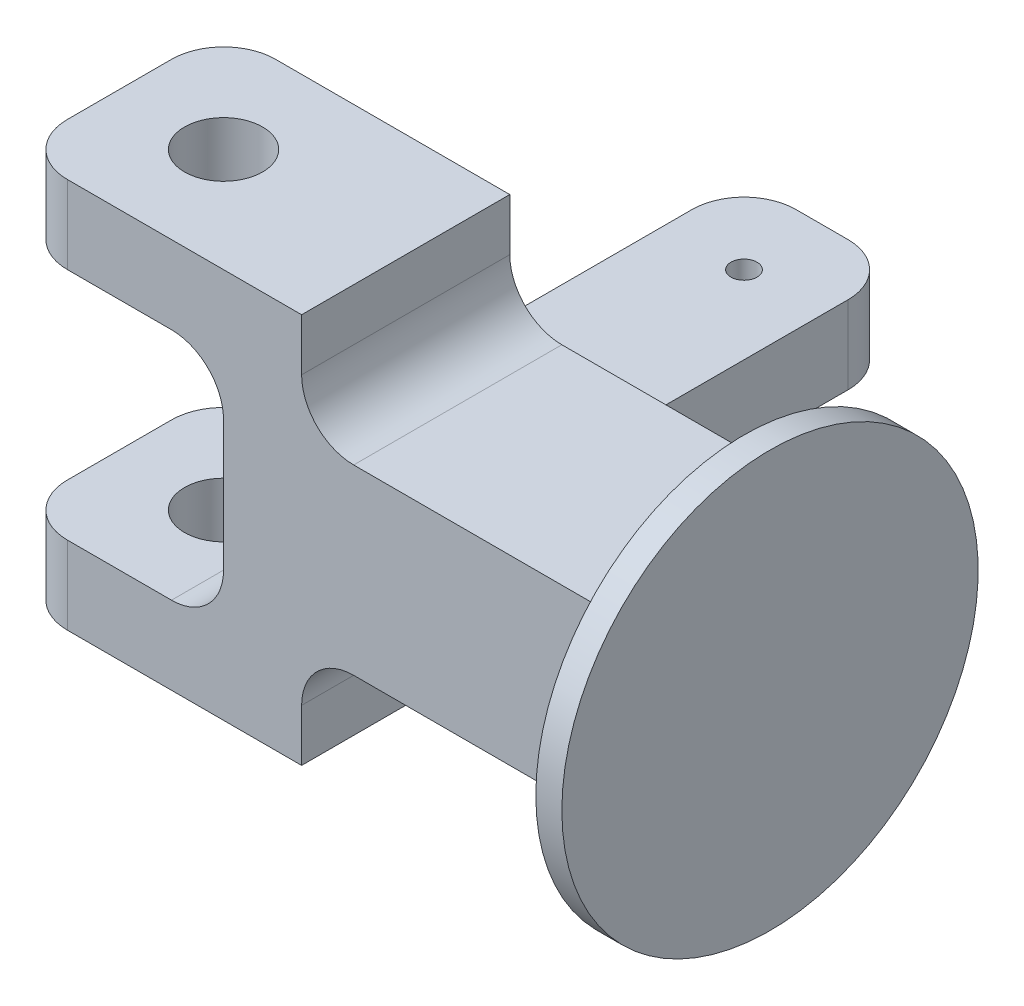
SolidWorks part; units mm, degrees
ref_plane "Front Plane" through (0, 0, 0) normal (0, 0, 1) x (1, 0, 0)
ref_plane "Top Plane" through (0, 0, 0) normal (0, 1, 0) x (1, 0, 0)
ref_plane "Right Plane" through (0, 0, 0) normal (1, 0, 0) x (0, 0, -1)
sketch "Sketch1" plane through (0, 0, 0) normal (0, 1, 0) x (1, 0, 0)
  line L0 (-63.5, -25.4) -> (76.2, -25.4)
  line L1 (-6.35, 95.25) -> (6.35, 95.25)
  line L2 (-19.05, 82.55) -> (-19.05, 25.4)
  line L4 (19.05, 82.55) -> (19.05, 25.4)
  line L5 (19.05, 25.4) -> (76.2, 25.4)
  line L8 (76.2, 25.4) -> (76.2, -25.4)
  line L10 (-19.05, 25.4) -> (-63.5, 25.4)
  line L11 (-76.2, -12.7) -> (-76.2, 12.7)
  circle A0 centre (0, 76.2) radius 3.175
  circle A1 centre (-50.8, 0) radius 9.525
  arc A2 (-19.05, 82.55) -> (-6.35, 95.25) centre (-6.35, 82.55) cw
  arc A3 (6.35, 95.25) -> (19.05, 82.55) centre (6.35, 82.55) cw
  arc A4 (-63.5, -25.4) -> (-76.2, -12.7) centre (-63.5, -12.7) cw
  arc A5 (-76.2, 12.7) -> (-63.5, 25.4) centre (-63.5, 12.7) cw
  dimension "D1" = 6.35
  dimension "D9" = 19.05
  dimension "D12" = 12.7
  dimension "D2" = 76.2
  dimension "D3" = 19.05
  dimension "D4" = 19.05
  dimension "D5" = 19.05
  dimension "D6" = 76.2
  dimension "D7" = 25.4
  dimension "D8" = 25.4
  dimension "D10" = 50.8
  dimension "D11" = 25.4
extrude "Boss-Extrude1" add sketch "Sketch1" along normal mid plane 95.25
sketch "Sketch2" plane through (0, 0, 25.4) normal (0, 0, 1) x (1, 0, 0)
  line L0 (-76.2, 47.625) -> (-76.2, -47.625) construction
  line L1 (-76.2, 28.575) -> (-38.1, 28.575)
  line L2 (-76.2, 28.575) -> (-76.2, -28.575)
  line L3 (-76.2, -28.575) -> (-38.1, -28.575)
  line L4 (-25.4, 15.875) -> (-25.4, -15.875)
  arc A0 (-38.1, -28.575) -> (-25.4, -15.875) centre (-38.1, -15.875) ccw
  arc A1 (-38.1, 28.575) -> (-25.4, 15.875) centre (-38.1, 15.875) cw
  point P9 (-25.4, -28.575)
  point P12 (-25.4, 28.575)
  dimension "D4" = 12.7
  dimension "D1" = 50.8
  dimension "D2" = 57.15
  dimension "D3" = 28.575
extrude "Cut-Extrude1" cut sketch "Sketch2" against normal through all
sketch "Sketch5" plane through (-19.05, 0, 0) normal (-1, 0, 0) x (0, 0, 1)
  line L0 (-25.4, 47.625) -> (-25.4, -47.625) construction
  line L1 (-95.25, 47.625) -> (-25.4, 47.625)
  line L2 (-95.25, 47.625) -> (-95.25, 9.525)
  line L3 (-95.25, 9.525) -> (-38.1, 9.525)
  line L4 (-25.4, 47.625) -> (-25.4, 22.225)
  line L5 (-25.4, -15.875) -> (-25.4, 15.875) construction
  line L6 (-38.1, -9.525) -> (-95.25, -9.525)
  line L7 (-25.4, -22.225) -> (-25.4, -47.625)
  line L8 (-25.4, -47.625) -> (-95.25, -47.625)
  line L9 (-95.25, -9.525) -> (-95.25, -47.625)
  arc A0 (-38.1, -9.525) -> (-25.4, -22.225) centre (-38.1, -22.225) cw
  arc A1 (-38.1, 9.525) -> (-25.4, 22.225) centre (-38.1, 22.225) ccw
  point P16 (-25.4, -9.525)
  point P19 (-25.4, 9.525)
  dimension "D3" = 12.7
  dimension "D1" = 19.05
extrude "Cut-Extrude2" cut sketch "Sketch5" against normal through all
sketch "Sketch6" plane through (0, 0, -25.4) normal (0, 0, -1) x (-1, 0, 0)
  line L0 (-76.2, 22.225) -> (-6.35, 22.225)
  line L1 (-76.2, 47.625) -> (-76.2, -47.625) construction
  line L2 (-19.05, 22.225) -> (19.05, 22.225) construction
  line L3 (6.35, 34.925) -> (6.35, 47.625)
  line L4 (-76.2, 47.625) -> (63.5, 47.625) construction
  line L5 (25.4, -15.875) -> (25.4, 15.875) construction
  line L6 (-76.2, 22.225) -> (-76.2, 47.625)
  line L7 (-76.2, 47.625) -> (6.35, 47.625)
  arc A0 (-6.35, 22.225) -> (6.35, 34.925) centre (-6.35, 34.925) ccw
  point P14 (6.35, 22.225)
  dimension "D2" = 12.7
  dimension "D1" = 19.05
extrude "Cut-Extrude3" cut sketch "Sketch6" against normal through all
mirror "Mirror1" about plane through (0, 0, 0) normal (0, 1, 0) of "Cut-Extrude3"
sketch "Sketch7" plane through (76.2, 0, 0) normal (1, 0, 0) x (0, 0, -1)
  circle A0 centre (0, 0) radius 50.8
  dimension "D1" = 101.6
extrude "Boss-Extrude2" add sketch "Sketch7" along normal blind 6.35
sketch "Sketch8" plane through (0, 0, 0) normal (0, 1, 0) x (1, 0, 0)
  line L0 (0, 0) -> (244.6914, 0) construction
  line L1 (0, 0) -> (-145.0703, 0) construction
ref_plane "Plane1" through (0, 0, -76.2) normal (0, 0, -1) x (-1, 0, 0)
sketch "Sketch9" plane through (0, 0, -76.2) normal (0, 0, -1) x (-1, 0, 0)
  line L0 (0, 26.4972) -> (0, -27.3538) construction
  line L1 (0, 9.525) -> (0, -9.525) construction
  line L2 (-6.35, 9.525) -> (6.35, 9.525) construction
  line L4 (-6.35, -9.525) -> (6.35, -9.525) construction
  point P5 (0, 17.0561)
  point P6 (0, -17.0561)
  dimension "D1" = 7.5311
  dimension "D2" = 7.5311
sketch "Sketch10" plane through (0, 0, 0) normal (0, 0, 1) x (1, 0, 0)
  line L0 (-50.8, -73.025) -> (-50.8, 73.025) construction
  line L1 (-50.8, 47.625) -> (-50.8, 28.575) construction
  line L2 (0, 0) -> (-145.0703, 0) construction
  point P5 (-50.8, 73.025)
  point P6 (-50.8, -73.025)
  dimension "D1" = 146.05
  dimension "D2" = 73.025
ref_plane "Plane2" through (0, 17.0561, -76.2) normal (0, -1, 0) x (-1, 0, 0)
sketch "Sketch11" plane through (0, 17.0561, -76.2) normal (0, -1, 0) x (-1, 0, 0)
  line L0 (50.8, -76.2) -> (50.8, 107.2912) construction
  line L1 (50.8, -76.2) -> (-0.5251, 118.7465) construction
  point P2 (21.699, 34.3334)
  dimension "D1" = 14.75
  dimension "D2" = 114.3
